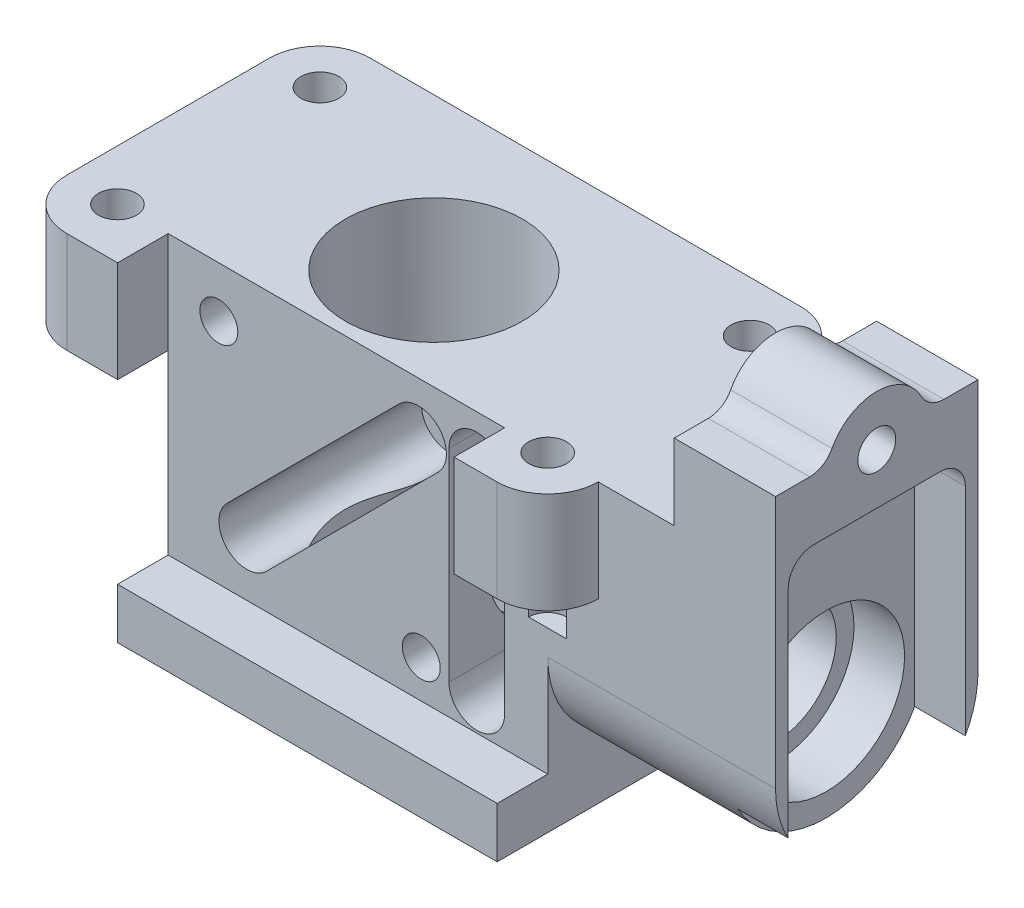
SolidWorks part; units mm, degrees
ref_plane "Front Plane" through (0, 0, 0) normal (0, 0, 1) x (1, 0, 0)
ref_plane "Top Plane" through (0, 0, 0) normal (0, 1, 0) x (1, 0, 0)
ref_plane "Right Plane" through (0, 0, 0) normal (1, 0, 0) x (0, 0, -1)
sketch "Sketch1" plane through (0, 0, 0) normal (0, 0, 1) x (1, 0, 0)
  line L0 (-7.5, 0) -> (-7.5, 4.5)
  line L1 (-7.5, 0) -> (0, 0)
  line L2 (0, 0) -> (0, 0.5)
  line L3 (0, 0.5) -> (4.5, 0.5)
  line L4 (4.5, 0.5) -> (4.5, 8)
  line L5 (4.5, 8) -> (2.4974, 8)
  line L7 (2.4974, 8) -> (2.4974, 6.5)
  line L9 (2.4974, 6.5) -> (-8.5026, 6.5)
  line L10 (-7.5, 4.5) -> (-8.5026, 4.5)
  line L11 (-8.5026, 4.5) -> (-8.5026, 6.5)
  dimension "D1" = 7.5
  dimension "D2" = 11
  dimension "D3" = 2.0026
  dimension "D4" = 7.5
  dimension "D5" = 1.0026
  dimension "D6" = 2
  dimension "D8" = 0.5
  dimension "D10" = 1.5
extrude "Boss-Extrude1" add sketch "Sketch1" along normal blind 6
sketch "Sketch3" plane through (4.5, 0, 0) normal (1, 0, 0) x (0, 0, -1)
  line L0 (-6, 3) -> (-3, 3) construction
  line L1 (-6, 0.5) -> (-6, 8) construction
  line L2 (-3, 3) -> (0, 3) construction
  line L3 (0, 0.5) -> (0, 8) construction
  line L4 (-6, 0.5) -> (0, 0.5) construction
  circle A0 centre (-3, 3) radius 1.2
  dimension "D2" = 2.4
  dimension "D1" = 2.5
extrude "Cut-Extrude2" cut sketch "Sketch3" against normal offset from surface (10 mm away) 2
sketch "Sketch5" plane through (0, 0, 0) normal (0, -1, 0) x (1, 0, 0)
  line L0 (-7.5, 0) -> (0, 0) construction
  line L4 (-7.5, 6) -> (-7.5, 0) construction
  circle A0 centre (-4.25, 3) radius 1.25
  dimension "D1" = 2.5
  dimension "D2" = 3.25
  dimension "D3" = 3
extrude "Cut-Extrude4" cut sketch "Sketch5" against normal through all
sketch "Sketch12" plane through (0, 0, 6) normal (0, 0, 1) x (1, 0, 0)
  line L0 (4.5, 0.5) -> (4.5, 8) construction
  line L5 (0, 0.5) -> (4.5, 0.5) construction
  line L7 (-1.9526, 5.6) -> (-1.9526, 1.6)
  line L8 (-7.5, 4.5) -> (-7.5, 0) construction
  line L9 (-2.9419, 5.8638) -> (-6.336, 2.4697)
  line L10 (-2.164, 5.086) -> (-5.5581, 1.6919)
  line L12 (-2.9419, 5.8638) -> (-5.5581, 1.6919) construction
  line L13 (-2.164, 5.086) -> (-6.336, 2.4697) construction
  line L14 (-0.8526, 5.6) -> (-0.8526, 1.6)
  line L15 (-4.25, 6.3) -> (-4.25, 3.7778) construction
  line L16 (-2.9419, 5.8638) -> (-2.9419, 1.6919) construction
  line L17 (-2.9419, 1.6919) -> (-5.5581, 1.6919) construction
  line L18 (-5.5581, 1.6919) -> (-5.6491, 1.6919) construction
  line L20 (-1.9526, 5.6) -> (-0.8526, 1.6) construction
  line L21 (-1.9526, 1.6) -> (-0.8526, 5.6) construction
  line L22 (-4.25, 1.6919) -> (-4.25, 0) construction
  line L25 (-4.25, 1.6919) -> (-4.25, 3) construction
  line L26 (-4.25, 3) -> (-2.6425, 3) construction
  arc A2 (-1.9526, 1.6) -> (-0.8526, 1.6) centre (-1.4026, 1.6) ccw
  arc A3 (-6.336, 2.4697) -> (-5.5581, 1.6919) centre (-5.9471, 2.0808) ccw
  arc A4 (-2.164, 5.086) -> (-2.9419, 5.8638) centre (-2.5529, 5.4749) ccw
  arc A5 (-0.8526, 5.6) -> (-1.9526, 5.6) centre (-1.4026, 5.6) ccw
  point P0 (-1.4026, 3.6)
  point P3 (0, 0)
  point P4 (-2.6425, 3)
  point P9 (-4.25, 3.7778)
  point P23 (-3.8611, 3.3889)
  dimension "D2" = 1.1
  dimension "D3" = 4.8
  dimension "D4" = 3.1
  dimension "D5" = 4
  dimension "D6" = 1.1
  dimension "D7" = 5.9026
  dimension "D8" = 2.5
  dimension "D9" = 45
  dimension "D10" = 3.25
extrude "Cut-Extrude10" cut sketch "Sketch12" against normal offset from surface (5 mm away) 1
sketch "Sketch13" plane through (0, 6.5, 0) normal (0, 1, 0) x (1, 0, 0)
  circle A0 centre (-4.25, -3) radius 1.75
  dimension "D1" = 3.5
extrude "Cut-Extrude11" cut sketch "Sketch13" against normal offset from surface (5.5 mm away) 1
sketch "Sketch14" plane through (4.5, 0, 0) normal (1, 0, 0) x (0, 0, -1)
  circle A0 centre (-3, 3) radius 1.55
  circle A1 centre (-3, 3) radius 1.2 construction
  dimension "D1" = 3.1
extrude "Cut-Extrude12" cut sketch "Sketch14" against normal blind 2
sketch "Sketch15" plane through (4.5, 0, 0) normal (1, 0, 0) x (0, 0, -1)
  line L0 (-3, 8) -> (-3, 6.8) construction
  line L1 (-4.75, -0.8) -> (-1.25, -0.8)
  line L2 (-4.75, -0.8) -> (-4.75, 6.8)
  line L3 (-4.75, 6.8) -> (-1.25, 6.8)
  line L4 (-1.25, -0.8) -> (-1.25, 6.8)
  line L5 (-6, 8) -> (0, 8) construction
  circle A0 centre (-3, 3) radius 1.55 construction
  dimension "D2" = 1.2
  dimension "D3" = 3.8
  dimension "D1" = 3.5
extrude "Cut-Extrude13" cut sketch "Sketch15" against normal blind 1
sketch "Sketch24" plane through (4.5, 0, 0) normal (1, 0, 0) x (0, 0, -1)
  line L0 (-5, 3) -> (-5, 8.0011)
  line L1 (-5, 8.0011) -> (-8.3387, 8.0011)
  line L2 (-8.3387, 8.0011) -> (-8.3387, -1.5075)
  line L3 (-8.3387, -1.5075) -> (2.514, -1.5075)
  line L4 (2.514, -1.5075) -> (2.514, 8.0011)
  line L5 (2.514, 8.0011) -> (-1, 8.0011)
  line L6 (-1, 8.0011) -> (-1, 3)
  arc A0 (-5, 3) -> (-1, 3) centre (-3, 3) ccw
  circle A2 centre (-3, 3) radius 1.55 construction
  circle A4 centre (-3, 3) radius 1.2 construction
  dimension "D1" = 0.8
extrude "Cut-Extrude23" cut sketch "Sketch24" against normal up to surface (4.5 mm away)
sketch "Sketch17" plane through (0, 0, 6) normal (0, 0, 1) x (1, 0, 0)
  line L0 (0, 6.5) -> (-8.5026, 6.5) construction
  line L1 (-7.5, 6.5) -> (0, 6.5)
  line L2 (-7.5, 6.5) -> (-7.5, 1)
  line L3 (-7.5, 1) -> (0, 1)
  line L4 (0, 6.5) -> (0, 1)
  line L5 (-7.5, 4.5) -> (-7.5, 0) construction
  line L6 (-7.5, 0) -> (0, 0) construction
  dimension "D1" = 7.5
  dimension "D2" = 1
extrude "Cut-Extrude24" cut sketch "Sketch17" against normal blind 1
sketch "Sketch26" plane through (0, 0, 5) normal (0, 0, 1) x (1, 0, 0)
  line L0 (-7.5, 4.5) -> (-7.5, 1) construction
  line L3 (0, 1) -> (0, 3) construction
  line L4 (2.4974, 6.5) -> (-7.5, 6.5) construction
  line L5 (-7.5, 1) -> (0, 1) construction
  circle A0 centre (-2.5, 1.75) radius 0.375
  circle A1 centre (-6.5, 5.5) radius 0.375
  dimension "D1" = 0.75
  dimension "D2" = 1
  dimension "D3" = 1
  dimension "D4" = 0.75
  dimension "D5" = 2.5
extrude "M1 Screws" cut sketch "Sketch26" against normal blind 3
sketch "Sketch28" plane through (4.5, 0, 0) normal (1, 0, 0) x (0, 0, -1)
  line L0 (-1.25, 6.8) -> (-4.75, 6.8) construction
  line L1 (-3, 3) -> (-3, 7.8) construction
  circle A0 centre (-3, 7.8) radius 1
  dimension "D1" = 2
  dimension "D2" = 1
extrude "Boss-Extrude2" add sketch "Sketch28" against normal up to surface (2.0026 mm away)
sketch "Sketch29" plane through (4.5, 0, 0) normal (1, 0, 0) x (0, 0, -1)
  circle A0 centre (-3, 7.8) radius 0.375
  dimension "D1" = 0.75
extrude "Cut-Extrude26" cut sketch "Sketch29" against normal up to surface (2.0026 mm away)
fillet "Fillet1" radius 0.5 2 edges at (3.4987, 8, 2.0202) (3.4987, 8, 3.9798)
fillet "Fillet2" radius 0.5 2 edges at (4, 6.8, 1.25) (4, 6.8, 4.75)
sketch "Sketch30" plane through (-8.5026, 0, 0) normal (-1, 0, 0) x (0, 0, 1)
  line L1 (0, 6.5) -> (6, 6.5)
  line L2 (0, 6.5) -> (0, 4.5)
  line L3 (0, 4.5) -> (6, 4.5)
  line L4 (6, 6.5) -> (6, 4.5)
extrude "Boss-Extrude4" add sketch "Sketch30" along normal blind 1
sketch "Sketch34" plane through (0, 6.5, 0) normal (0, 1, 0) x (1, 0, 0)
  line L0 (-9.5026, -6) -> (-9.5026, 0) construction
  line L1 (0, 0) -> (0.9974, 0)
  line L2 (0, 0) -> (0, -1)
  line L3 (0, -1) -> (0.9974, -1)
  line L4 (0.9974, 0) -> (0.9974, -1)
  line L5 (-7.5, -6) -> (-9.5026, -6) construction
  line L6 (-0.8526, -6) -> (0.9974, -6)
  line L7 (-0.8526, -6) -> (-0.8526, -5)
  line L8 (-0.8526, -5) -> (0.9974, -5)
  line L9 (0.9974, -6) -> (0.9974, -5)
  line L10 (-7.5, -5) -> (2.4974, -5) construction
  dimension "D1" = 10.5
  dimension "D2" = 1.85
extrude "Boss-Extrude5" add sketch "Sketch34" against normal blind 2
sketch "Sketch32" plane through (0, 6.5, 0) normal (0, 1, 0) x (1, 0, 0)
  line L0 (-8.5026, 0) -> (-8.5026, -1) construction
  line L1 (0.9974, 0) -> (-9.5026, 0) construction
  line L2 (-8.5026, -1) -> (-8.5026, -5) construction
  line L3 (-8.5026, -5) -> (-8.5013, -6) construction
  line L4 (-7.5, -6) -> (-9.5026, -6) construction
  line L5 (-9.5026, -6) -> (-9.5026, 0) construction
  line L6 (-8.5026, -1) -> (-0.0026, -1) construction
  line L7 (0.9974, -1) -> (0.9974, 0) construction
  line L8 (-0.0026, -1) -> (-0.0026, -5) construction
  line L9 (-0.0026, -5) -> (-8.5026, -5) construction
  circle A0 centre (-8.5026, -1) radius 0.375
  circle A1 centre (-8.5026, -5) radius 0.375
  circle A2 centre (-0.0026, -1) radius 0.375
  circle A3 centre (-0.0026, -5) radius 0.375
  dimension "D2" = 0.75
  dimension "D4" = 1
  dimension "D1" = 1
  dimension "D3" = 1
extrude "Cut-Extrude27" cut sketch "Sketch32" against normal blind 3
fillet "Fillet5" radius 1 4 edges at (0.9974, 5.5, 0) (-9.5026, 5.5, 0) (-9.5026, 5.5, 6) (0.9974, 5.5, 6)
sketch "Sketch36" plane through (0, 0, 0) normal (0, -1, 0) x (1, 0, 0)
  line L0 (-1.5, 0) -> (0, 1.5)
  line L2 (0, 1.5) -> (0, 0)
  line L3 (0, 0) -> (-1.5, 0)
  line L5 (-7.5, 0) -> (-0.0026, 0) construction
  line L6 (0, 6) -> (0, 0) construction
  dimension "D1" = 1.5
extrude "Cut-Extrude30" cut sketch "Sketch36" against normal blind 3
fillet "Fillet6" radius 1 1 edges at (-7.5, 2.25, 0)
sketch "Sketch37" plane through (0, 0, 0) normal (0, -1, 0) x (1, 0, 0)
  line L1 (-1.25, 5) -> (-6.25, 5) construction
  line L2 (-1.25, 5) -> (-1.25, 1) construction
  line L3 (-1.25, 1) -> (-6.25, 1) construction
  line L4 (-6.25, 5) -> (-6.25, 1) construction
  circle A0 centre (-6.25, 5) radius 0.795
  circle A1 centre (-1.25, 5) radius 0.795
  circle A2 centre (-1.25, 1) radius 0.795
  circle A3 centre (-6.25, 1) radius 0.795
  point P0 (-4.25, 3)
  dimension "D4" = 1.59
  dimension "D1" = 2
  dimension "D2" = 3
  dimension "D3" = 4
  dimension "D5" = 2
extrude "Cut-Extrude31" cut sketch "Sketch37" against normal blind 0.79
